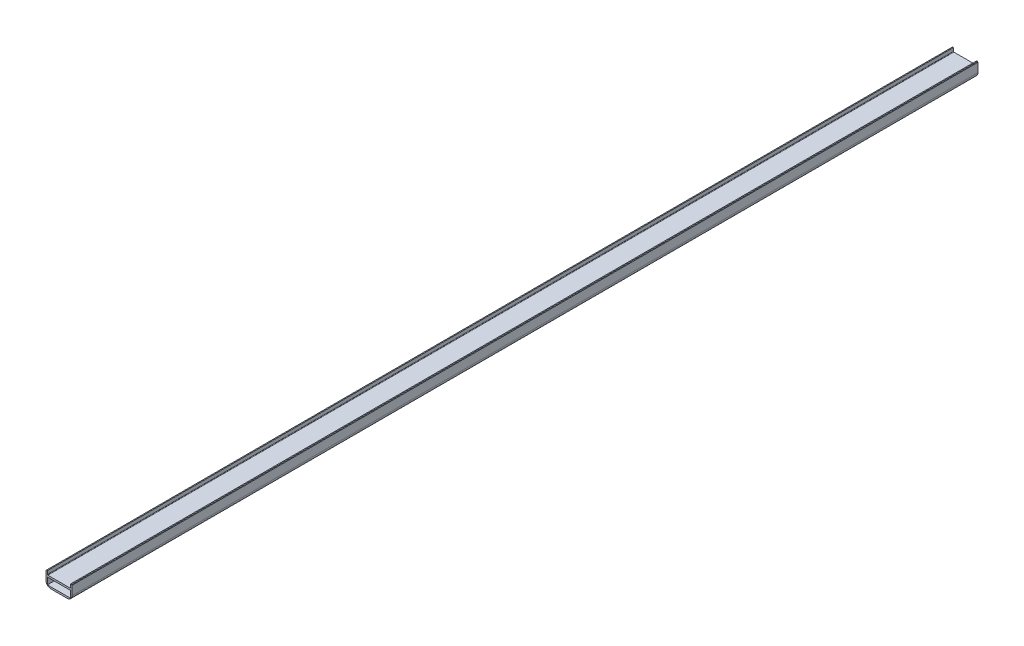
SolidWorks part; units mm, degrees
ref_plane "Front Plane" through (0, 0, 0) normal (0, 0, 1) x (1, 0, 0)
ref_plane "Top Plane" through (0, 0, 0) normal (0, 1, 0) x (1, 0, 0)
ref_plane "Right Plane" through (0, 0, 0) normal (1, 0, 0) x (0, 0, -1)
sketch "Sketch2" plane through (0, 0, 0) normal (0, 0, 1) x (1, 0, 0)
  line L0 (-24.5, 3.0277) -> (-27.5, 3.0277)
  line L1 (-27.5, 3.0277) -> (-27.5, -26.9723)
  line L2 (0, -4.9723) -> (0, 3.0277) construction
  line L3 (-24.5, 3.0277) -> (-24.5, -3.9723)
  line L4 (-23.5, -4.9723) -> (23.5, -4.9723)
  line L6 (27.5, -26.9723) -> (-27.5, -26.9723)
  line L7 (24.5, 3.0277) -> (24.5, -3.9723)
  line L8 (27.5, 3.0277) -> (27.5, -26.9723)
  line L9 (24.5, 3.0277) -> (27.5, 3.0277)
  arc A1 (-23.5, -4.9723) -> (-24.5, -3.9723) centre (-23.5, -3.9723) cw
  arc A2 (23.5, -4.9723) -> (24.5, -3.9723) centre (23.5, -3.9723) ccw
  point P11 (-11.5, -21.6228)
  point P22 (11.5, -21.6228)
  dimension "D1" = 27.5
  dimension "D2" = 3
  dimension "D3" = 4.9723
  dimension "D4" = 30
extrude "Boss-Extrude1" add sketch "Sketch2" along normal mid plane 1920
fillet "Fillet1" radius 10 2 edges at (27.5, -26.9723, 0) (-27.5, -26.9723, 0)
chamfer "Chamfer1" distance 1 angle 45 2 edges at (27.5, 3.0277, 0) (-27.5, 3.0277, 0)
sketch "Sketch5" plane through (0, 0, 960) normal (0, 0, 1) x (1, 0, 0)
  line L0 (0, -4.9723) -> (0, -26.9723) construction
  line L1 (23.5, -4.9723) -> (-23.5, -4.9723) construction
  line L2 (-17.5, -26.9723) -> (17.5, -26.9723) construction
  line L3 (24.5, 3.0277) -> (24.5, -3.9723) construction
  line L4 (-24.5, -8.7781) -> (24.5, -8.7781)
  line L5 (-24.5, -8.7781) -> (-24.5, -23.1664)
  line L6 (-24.5, -23.1664) -> (24.5, -23.1664)
  line L7 (24.5, -8.7781) -> (24.5, -23.1664)
  line L8 (-24.5, -8.7781) -> (24.5, -23.1664) construction
  line L9 (-24.5, -23.1664) -> (24.5, -8.7781) construction
  line L10 (-24.5, -3.9723) -> (-24.5, 3.0277) construction
  point P6 (0, -15.9723)
extrude "Cut-Extrude1" cut sketch "Sketch5" against normal blind 2007
